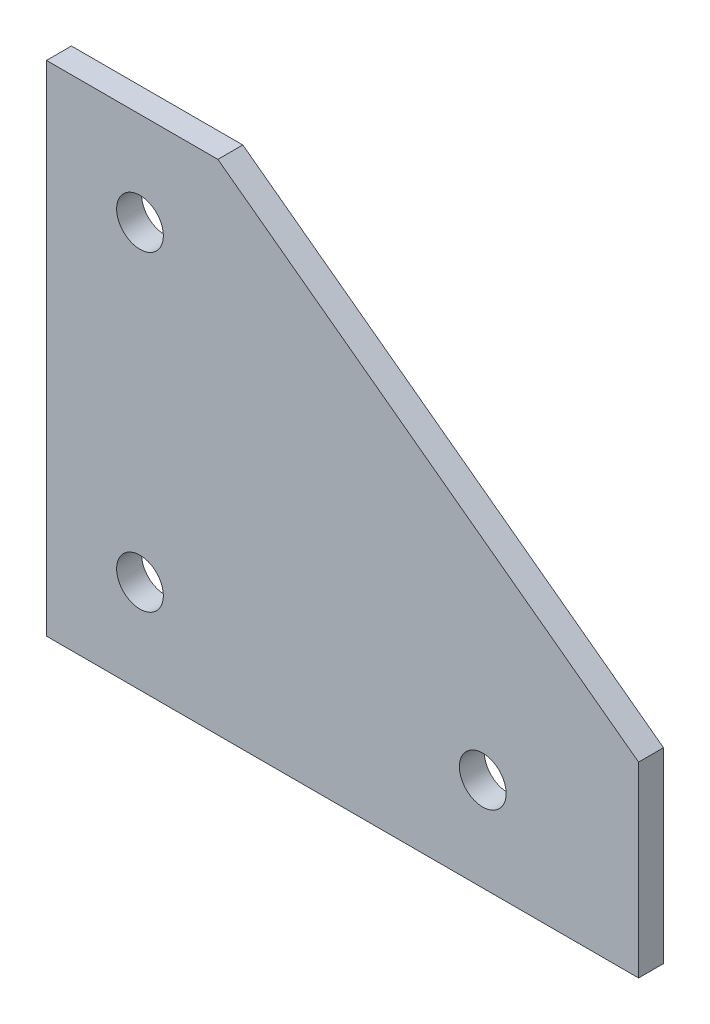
SolidWorks part; units mm, degrees
ref_plane "前视基准面" through (0, 0, 0) normal (0, 0, 1) x (1, 0, 0)
ref_plane "上视基准面" through (0, 0, 0) normal (0, 1, 0) x (1, 0, 0)
ref_plane "右视基准面" through (0, 0, 0) normal (1, 0, 0) x (0, 0, -1)
sketch "草图1" plane through (0, 0, 0) normal (0, 0, 1) x (1, 0, 0)
  line L0 (0, 0) -> (190, 0)
  line L1 (190, 0) -> (190, 60)
  line L2 (190, 60) -> (55, 160)
  line L3 (55, 160) -> (0, 160)
  line L4 (0, 160) -> (0, 0)
  line L5 (21.6937, 30) -> (189.962, 30) construction
  line L6 (30, 143.3717) -> (30, 14.3381) construction
  circle A0 centre (30, 30) radius 7.5
  circle A1 centre (140, 30) radius 7.5
  circle A2 centre (30, 130) radius 7.5
  dimension "D6" = 110
  dimension "D7" = 30
  dimension "D8" = 100
  dimension "D9" = 15
  dimension "D10" = 15
  dimension "D11" = 15
  dimension "D1" = 55
  dimension "D2" = 60
  dimension "D3" = 160
  dimension "D4" = 190
  dimension "D5" = 30
extrude "拉伸1" add sketch "草图1" along normal blind 8
